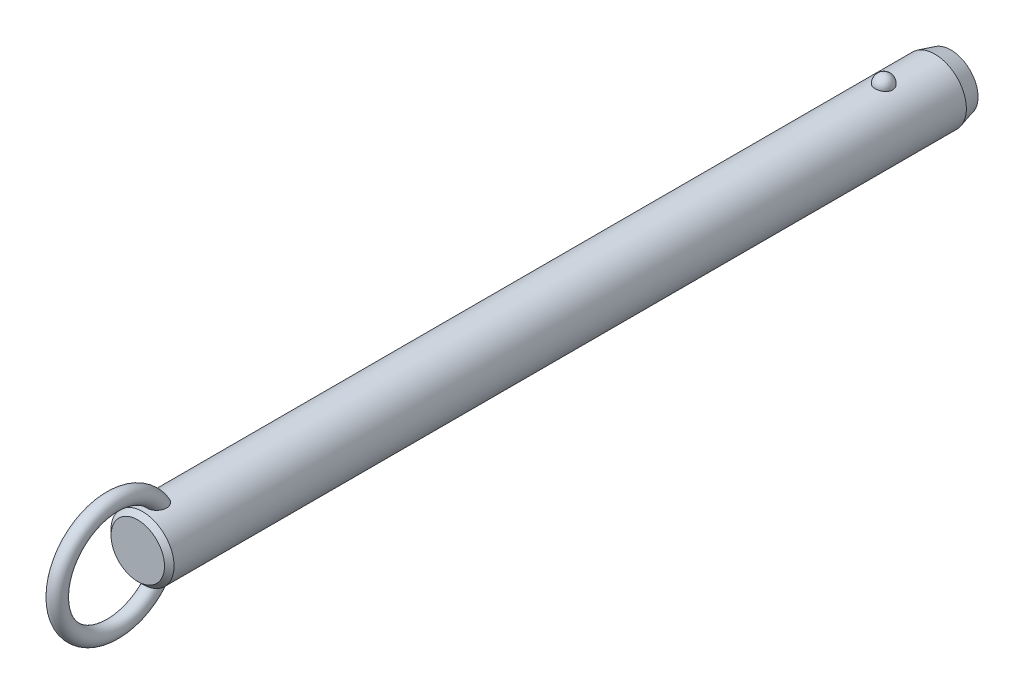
SolidWorks part; units mm, degrees
ref_plane "Front Plane" through (0, 0, 0) normal (0, 0, 1) x (1, 0, 0)
ref_plane "Top Plane" through (0, 0, 0) normal (0, 1, 0) x (1, 0, 0)
ref_plane "Right Plane" through (0, 0, 0) normal (1, 0, 0) x (0, 0, -1)
sketch "Sketch2" plane through (0, 0, 0) normal (0, 0, 1) x (1, 0, 0)
  circle A0 centre (0, 0) radius 7.9
  point P3 (0, 7.9)
  dimension "D1" = 15.8
extrude "Boss-Extrude1" add sketch "Sketch2" along normal blind 175.3
sketch "Sketch3" plane through (0, 0, 0) normal (0, 0, -1) x (-1, 0, 0)
  circle A0 centre (0, 0) radius 7.9
  dimension "D1" = 15.8
extrude "Boss-Extrude2" add sketch "Sketch3" along normal blind 19
chamfer "Chamfer1" distance 4 angle 15 1 edges at (-7.9, 0, -19)
sketch "Sketch12" plane through (0, 0, 0) normal (1, 0, 0) x (0, 0, -1)
  line L0 (-175.3, 7.9) -> (-175.3, -7.9) construction
  point P0 (-175.3, 0)
sketch "Sketch13" plane through (0, 0, 0) normal (1, 0, 0) x (0, 0, -1)
  circle A0 centre (-191.15, 0) radius 15.85
  point P2 (-175.3, 0)
  dimension "D1" = 31.7
sketch "Sketch14" plane through (0, 0, 0) normal (0, 1, 0) x (1, 0, 0)
  circle A0 centre (0, -177.3) radius 2
  point P2 (0, -175.3)
  dimension "D1" = 4
sweep "Sweep1" add profiles "Sketch14" path "Sketch13"
sketch "Sketch15" plane through (0, 0, 175.3) normal (0, 0, 1) x (1, 0, 0)
  circle A0 centre (0, 0) radius 7.9
  dimension "D1" = 15.8
extrude "Boss-Extrude3" add sketch "Sketch15" along normal blind 9.52
chamfer "Chamfer2" distance 1.2 angle 45 1 edges at (7.9, 0, 184.82)
sketch "Sketch18" plane through (0, 0, 0) normal (1, 0, 0) x (0, 0, -1)
  line L0 (15, 7.9) -> (-177.4091, 7.9) construction
  line L1 (2.2, 10.1) -> (2.2, 5.7)
  line L2 (-177.4091, -7.9) -> (15, -7.9) construction
  arc A0 (2.2, 10.1) -> (2.2, 5.7) centre (2.2, 7.9) ccw
  point P4 (0, 7.9)
  dimension "D1" = 18
revolve "Revolve1" add sketch "Sketch18" angle 360 about L1
